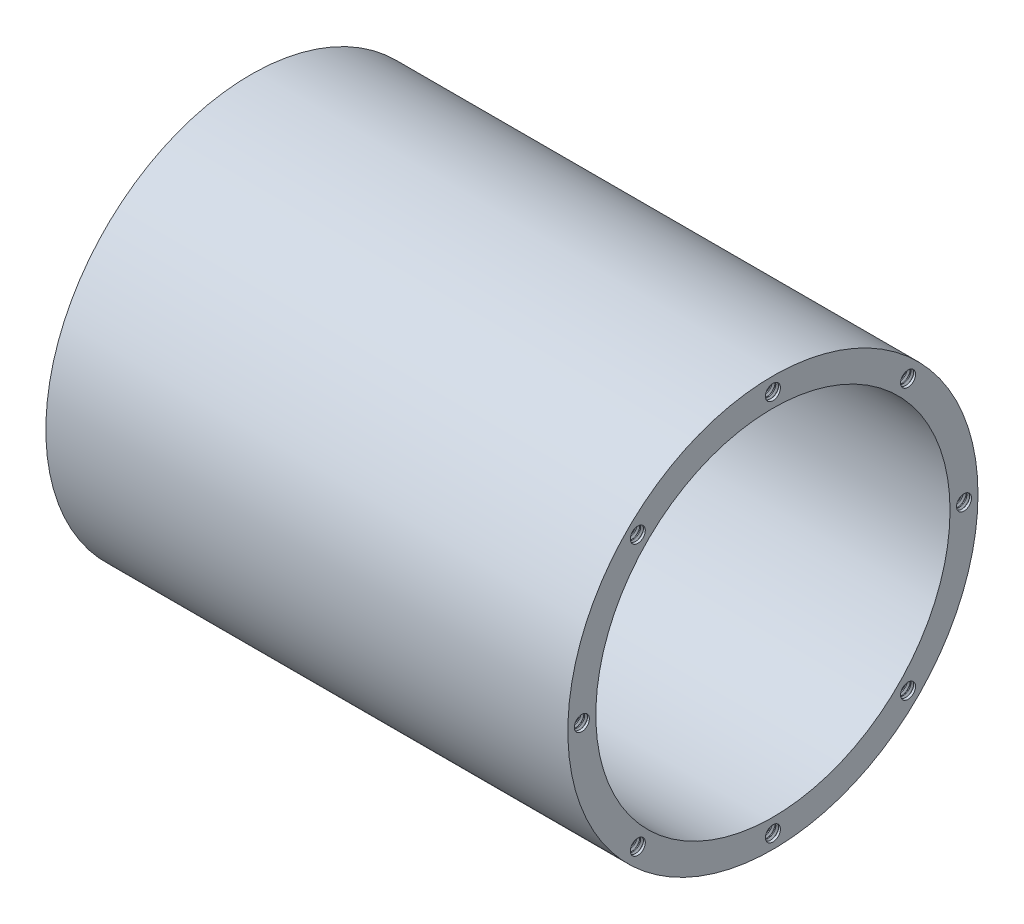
SolidWorks part; units mm, degrees
ref_plane "Front Plane" through (0, 0, 0) normal (0, 0, 1) x (1, 0, 0)
ref_plane "Top Plane" through (0, 0, 0) normal (0, 1, 0) x (1, 0, 0)
ref_plane "Right Plane" through (0, 0, 0) normal (1, 0, 0) x (0, 0, -1)
sketch "Sketch1" plane through (0, 0, 0) normal (1, 0, 0) x (0, 0, -1)
  circle A0 centre (0, 0) radius 69.85
  circle A1 centre (0, 0) radius 60.325
  dimension "D1" = 139.7
  dimension "D2" = 120.65
extrude "Boss-Extrude1" add sketch "Sketch1" along normal blind 177.8
sketch "Sketch2" plane through (0, 0, 0) normal (-1, 0, 0) x (0, 0, 1)
  line L0 (0, 0) -> (-65.0875, 0) construction
  circle A0 centre (0, 65.0875) radius 2.5527
  circle A1 centre (0, 0) radius 65.0875 construction
  circle A2 centre (46.0238, 46.0238) radius 2.5527
  circle A3 centre (65.0875, 0) radius 2.5527
  circle A4 centre (46.0238, -46.0238) radius 2.5527
  circle A5 centre (0, -65.0875) radius 2.5527
  circle A6 centre (-46.0238, -46.0238) radius 2.5527
  circle A7 centre (-65.0875, 0) radius 2.5527
  circle A8 centre (-46.0238, 46.0238) radius 2.5527
  point P4 (0, 0)
  point P5 (-65.0875, 0)
  point P21 (0, 0)
  dimension "D1" = 5.1054
  dimension "D2" = 65.0875
  dimension "D3" = 8
extrude "Cut-Extrude1" cut sketch "Sketch2" against normal blind 12.7
thread "Thread1" pitch 1.27 start angle 0, offset 0, length 12.7, pitch 1.27, diameter 5.1054
ref_plane "Plane2" through (0, 46.0238, -48.5765) normal (0, -1, 0) x (0, 0, -1)
sketch "Thread Profile2" plane through (0, 46.0238, -48.5765) normal (0, -1, 0) x (0, 0, -1)
  line L0 (0, 0) -> (0, 1.27) construction
  line L1 (0, 0) -> (0.6874, 0.3969)
  line L2 (0.6874, 0.3969) -> (0.6874, 0.5556)
  line L3 (0.6874, 0.5556) -> (0, 0.9525)
  line L4 (0.6874, 0.4762) -> (0, 0.4762) construction
  line L11 (0, 0) -> (0, 0.9525)
  point P2 (0, 0)
  dimension "Pitch" = 1.27
  dimension "Profile_Angle" = 60
  dimension "Profile_Land" = 0.1588
  dimension "Profile_Height" = 0.6874
thread "Thread2" pitch 1.27 start angle 0, offset 0, length 12.7, pitch 1.27, diameter 5.1054
ref_plane "Plane3" through (0, -65.0875, -2.5527) normal (0, -1, 0) x (0, 0, -1)
sketch "Thread Profile3" plane through (0, -65.0875, -2.5527) normal (0, -1, 0) x (0, 0, -1)
  line L0 (0, 0) -> (0, 1.27) construction
  line L1 (0, 0) -> (0.6874, 0.3969)
  line L2 (0.6874, 0.3969) -> (0.6874, 0.5556)
  line L3 (0.6874, 0.5556) -> (0, 0.9525)
  line L4 (0.6874, 0.4762) -> (0, 0.4762) construction
  line L11 (0, 0) -> (0, 0.9525)
  point P2 (0, 0)
  dimension "Pitch" = 1.27
  dimension "Profile_Angle" = 60
  dimension "Profile_Land" = 0.1588
  dimension "Profile_Height" = 0.6874
thread "Thread3" pitch 1.27 start angle 0, offset 0, length 12.7, pitch 1.27, diameter 5.1054
ref_plane "Plane5" through (0, -46.0238, -48.5765) normal (0, -1, 0) x (0, 0, -1)
sketch "Thread Profile5" plane through (0, -46.0238, -48.5765) normal (0, -1, 0) x (0, 0, -1)
  line L0 (0, 0) -> (0, 1.27) construction
  line L1 (0, 0) -> (0.6874, 0.3969)
  line L2 (0.6874, 0.3969) -> (0.6874, 0.5556)
  line L3 (0.6874, 0.5556) -> (0, 0.9525)
  line L4 (0.6874, 0.4762) -> (0, 0.4762) construction
  line L11 (0, 0) -> (0, 0.9525)
  point P2 (0, 0)
  dimension "Pitch" = 1.27
  dimension "Profile_Angle" = 60
  dimension "Profile_Land" = 0.1588
  dimension "Profile_Height" = 0.6874
thread "Thread4" pitch 1.27 start angle 0, offset 0, length 12.7, pitch 1.27, diameter 5.1054
ref_plane "Plane6" through (0, 0, -67.6402) normal (0, -1, 0) x (0, 0, -1)
sketch "Thread Profile6" plane through (0, 0, -67.6402) normal (0, -1, 0) x (0, 0, -1)
  line L0 (0, 0) -> (0, 1.27) construction
  line L1 (0, 0) -> (0.6874, 0.3969)
  line L2 (0.6874, 0.3969) -> (0.6874, 0.5556)
  line L3 (0.6874, 0.5556) -> (0, 0.9525)
  line L4 (0.6874, 0.4762) -> (0, 0.4762) construction
  line L11 (0, 0) -> (0, 0.9525)
  point P2 (0, 0)
  dimension "Pitch" = 1.27
  dimension "Profile_Angle" = 60
  dimension "Profile_Land" = 0.1588
  dimension "Profile_Height" = 0.6874
thread "Thread5" pitch 1.27 start angle 0, offset 0, length 12.7, pitch 1.27, diameter 5.1054
ref_plane "Plane7" through (0, 65.0875, -2.5527) normal (0, -1, 0) x (0, 0, -1)
sketch "Thread Profile7" plane through (0, 65.0875, -2.5527) normal (0, -1, 0) x (0, 0, -1)
  line L0 (0, 0) -> (0, 1.27) construction
  line L1 (0, 0) -> (0.6874, 0.3969)
  line L2 (0.6874, 0.3969) -> (0.6874, 0.5556)
  line L3 (0.6874, 0.5556) -> (0, 0.9525)
  line L4 (0.6874, 0.4762) -> (0, 0.4762) construction
  line L11 (0, 0) -> (0, 0.9525)
  point P2 (0, 0)
  dimension "Pitch" = 1.27
  dimension "Profile_Angle" = 60
  dimension "Profile_Land" = 0.1588
  dimension "Profile_Height" = 0.6874
thread "Thread6" pitch 1.27 start angle 0, offset 0, length 12.7, pitch 1.27, diameter 5.1054
ref_plane "Plane8" through (0, -46.0238, 43.4711) normal (0, -1, 0) x (0, 0, -1)
sketch "Thread Profile8" plane through (0, -46.0238, 43.4711) normal (0, -1, 0) x (0, 0, -1)
  line L0 (0, 0) -> (0, 1.27) construction
  line L1 (0, 0) -> (0.6874, 0.3969)
  line L2 (0.6874, 0.3969) -> (0.6874, 0.5556)
  line L3 (0.6874, 0.5556) -> (0, 0.9525)
  line L4 (0.6874, 0.4762) -> (0, 0.4762) construction
  line L11 (0, 0) -> (0, 0.9525)
  point P2 (0, 0)
  dimension "Pitch" = 1.27
  dimension "Profile_Angle" = 60
  dimension "Profile_Land" = 0.1588
  dimension "Profile_Height" = 0.6874
thread "Thread7" pitch 1.27 start angle 0, offset 0, length 12.7, pitch 1.27, diameter 5.1054
ref_plane "Plane9" through (0, 46.0238, 43.4711) normal (0, -1, 0) x (0, 0, -1)
sketch "Thread Profile9" plane through (0, 46.0238, 43.4711) normal (0, -1, 0) x (0, 0, -1)
  line L0 (0, 0) -> (0, 1.27) construction
  line L1 (0, 0) -> (0.6874, 0.3969)
  line L2 (0.6874, 0.3969) -> (0.6874, 0.5556)
  line L3 (0.6874, 0.5556) -> (0, 0.9525)
  line L4 (0.6874, 0.4762) -> (0, 0.4762) construction
  line L11 (0, 0) -> (0, 0.9525)
  point P2 (0, 0)
  dimension "Pitch" = 1.27
  dimension "Profile_Angle" = 60
  dimension "Profile_Land" = 0.1588
  dimension "Profile_Height" = 0.6874
thread "Thread8" pitch 1.27 start angle 0, offset 0, length 12.7, pitch 1.27, diameter 5.1054
ref_plane "Plane10" through (0, 0, 62.5348) normal (0, -1, 0) x (0, 0, -1)
sketch "Thread Profile10" plane through (0, 0, 62.5348) normal (0, -1, 0) x (0, 0, -1)
  line L0 (0, 0) -> (0, 1.27) construction
  line L1 (0, 0) -> (0.6874, 0.3969)
  line L2 (0.6874, 0.3969) -> (0.6874, 0.5556)
  line L3 (0.6874, 0.5556) -> (0, 0.9525)
  line L4 (0.6874, 0.4762) -> (0, 0.4762) construction
  line L11 (0, 0) -> (0, 0.9525)
  point P2 (0, 0)
  dimension "Pitch" = 1.27
  dimension "Profile_Angle" = 60
  dimension "Profile_Land" = 0.1588
  dimension "Profile_Height" = 0.6874
sketch "Sketch27" plane through (177.8, 0, 0) normal (1, 0, 0) x (0, 0, -1)
  circle A0 centre (0, 65.0875) radius 2.5527
  circle A1 centre (46.0238, 46.0238) radius 2.5527
  circle A2 centre (65.0875, 0) radius 2.5527
  circle A3 centre (46.0238, -46.0238) radius 2.5527
  circle A4 centre (0, -65.0875) radius 2.5527
  circle A5 centre (-46.0238, -46.0238) radius 2.5527
  circle A6 centre (-65.0875, 0) radius 2.5527
  circle A7 centre (-46.0238, 46.0238) radius 2.5527
  point P4 (0, 0)
  point P5 (0, 0)
  point P19 (0, 0)
  dimension "D1" = 5.1054
  dimension "D2" = 8
extrude "Cut-Extrude2" cut sketch "Sketch27" against normal blind 12.7
thread "Thread9" pitch 1.27 start angle 0, offset 0, length 12.7, pitch 1.27, diameter 5.1054
ref_plane "Plane11" through (177.8, 46.0238, 48.5765) normal (0, -1, 0) x (0, 0, 1)
sketch "Thread Profile11" plane through (177.8, 46.0238, 48.5765) normal (0, -1, 0) x (0, 0, 1)
  line L0 (0, 0) -> (0, 1.27) construction
  line L1 (0, 0) -> (0.6874, 0.3969)
  line L2 (0.6874, 0.3969) -> (0.6874, 0.5556)
  line L3 (0.6874, 0.5556) -> (0, 0.9525)
  line L4 (0.6874, 0.4762) -> (0, 0.4762) construction
  line L11 (0, 0) -> (0, 0.9525)
  point P2 (0, 0)
  dimension "Pitch" = 1.27
  dimension "Profile_Angle" = 60
  dimension "Profile_Land" = 0.1588
  dimension "Profile_Height" = 0.6874
thread "Thread10" pitch 1.27 start angle 0, offset 0, length 12.7, pitch 1.27, diameter 5.1054
ref_plane "Plane12" through (177.8, 0, 67.6402) normal (0, -1, 0) x (0, 0, 1)
sketch "Thread Profile12" plane through (177.8, 0, 67.6402) normal (0, -1, 0) x (0, 0, 1)
  line L0 (0, 0) -> (0, 1.27) construction
  line L1 (0, 0) -> (0.6874, 0.3969)
  line L2 (0.6874, 0.3969) -> (0.6874, 0.5556)
  line L3 (0.6874, 0.5556) -> (0, 0.9525)
  line L4 (0.6874, 0.4762) -> (0, 0.4762) construction
  line L11 (0, 0) -> (0, 0.9525)
  point P2 (0, 0)
  dimension "Pitch" = 1.27
  dimension "Profile_Angle" = 60
  dimension "Profile_Land" = 0.1588
  dimension "Profile_Height" = 0.6874
thread "Thread11" pitch 1.27 start angle 0, offset 0, length 12.7, pitch 1.27, diameter 5.1054
ref_plane "Plane13" through (177.8, -46.0238, 48.5765) normal (0, -1, 0) x (0, 0, 1)
sketch "Thread Profile13" plane through (177.8, -46.0238, 48.5765) normal (0, -1, 0) x (0, 0, 1)
  line L0 (0, 0) -> (0, 1.27) construction
  line L1 (0, 0) -> (0.6874, 0.3969)
  line L2 (0.6874, 0.3969) -> (0.6874, 0.5556)
  line L3 (0.6874, 0.5556) -> (0, 0.9525)
  line L4 (0.6874, 0.4762) -> (0, 0.4762) construction
  line L11 (0, 0) -> (0, 0.9525)
  point P2 (0, 0)
  dimension "Pitch" = 1.27
  dimension "Profile_Angle" = 60
  dimension "Profile_Land" = 0.1588
  dimension "Profile_Height" = 0.6874
thread "Thread12" pitch 1.27 start angle 0, offset 0, length 12.7, pitch 1.27, diameter 5.1054
ref_plane "Plane14" through (177.8, -65.0875, 2.5527) normal (0, -1, 0) x (0, 0, 1)
sketch "Thread Profile14" plane through (177.8, -65.0875, 2.5527) normal (0, -1, 0) x (0, 0, 1)
  line L0 (0, 0) -> (0, 1.27) construction
  line L1 (0, 0) -> (0.6874, 0.3969)
  line L2 (0.6874, 0.3969) -> (0.6874, 0.5556)
  line L3 (0.6874, 0.5556) -> (0, 0.9525)
  line L4 (0.6874, 0.4762) -> (0, 0.4762) construction
  line L11 (0, 0) -> (0, 0.9525)
  point P2 (0, 0)
  dimension "Pitch" = 1.27
  dimension "Profile_Angle" = 60
  dimension "Profile_Land" = 0.1588
  dimension "Profile_Height" = 0.6874
thread "Thread13" pitch 1.27 start angle 0, offset 0, length 12.7, pitch 1.27, diameter 5.1054
ref_plane "Plane15" through (177.8, -46.0238, -43.4711) normal (0, -1, 0) x (0, 0, 1)
sketch "Thread Profile15" plane through (177.8, -46.0238, -43.4711) normal (0, -1, 0) x (0, 0, 1)
  line L0 (0, 0) -> (0, 1.27) construction
  line L1 (0, 0) -> (0.6874, 0.3969)
  line L2 (0.6874, 0.3969) -> (0.6874, 0.5556)
  line L3 (0.6874, 0.5556) -> (0, 0.9525)
  line L4 (0.6874, 0.4762) -> (0, 0.4762) construction
  line L11 (0, 0) -> (0, 0.9525)
  point P2 (0, 0)
  dimension "Pitch" = 1.27
  dimension "Profile_Angle" = 60
  dimension "Profile_Land" = 0.1588
  dimension "Profile_Height" = 0.6874
thread "Thread14" pitch 1.27 start angle 0, offset 0, length 12.7, pitch 1.27, diameter 5.1054
ref_plane "Plane16" through (177.8, 0, -62.5348) normal (0, -1, 0) x (0, 0, 1)
sketch "Thread Profile16" plane through (177.8, 0, -62.5348) normal (0, -1, 0) x (0, 0, 1)
  line L0 (0, 0) -> (0, 1.27) construction
  line L1 (0, 0) -> (0.6874, 0.3969)
  line L2 (0.6874, 0.3969) -> (0.6874, 0.5556)
  line L3 (0.6874, 0.5556) -> (0, 0.9525)
  line L4 (0.6874, 0.4762) -> (0, 0.4762) construction
  line L11 (0, 0) -> (0, 0.9525)
  point P2 (0, 0)
  dimension "Pitch" = 1.27
  dimension "Profile_Angle" = 60
  dimension "Profile_Land" = 0.1588
  dimension "Profile_Height" = 0.6874
thread "Thread15" pitch 1.27 start angle 0, offset 0, length 12.7, pitch 1.27, diameter 5.1054
ref_plane "Plane17" through (177.8, 46.0238, -43.4711) normal (0, -1, 0) x (0, 0, 1)
sketch "Thread Profile17" plane through (177.8, 46.0238, -43.4711) normal (0, -1, 0) x (0, 0, 1)
  line L0 (0, 0) -> (0, 1.27) construction
  line L1 (0, 0) -> (0.6874, 0.3969)
  line L2 (0.6874, 0.3969) -> (0.6874, 0.5556)
  line L3 (0.6874, 0.5556) -> (0, 0.9525)
  line L4 (0.6874, 0.4762) -> (0, 0.4762) construction
  line L11 (0, 0) -> (0, 0.9525)
  point P2 (0, 0)
  dimension "Pitch" = 1.27
  dimension "Profile_Angle" = 60
  dimension "Profile_Land" = 0.1588
  dimension "Profile_Height" = 0.6874
thread "Thread16" pitch 1.27 start angle 0, offset 0, length 12.7, pitch 1.27, diameter 5.1054
ref_plane "Plane18" through (177.8, 65.0875, 2.5527) normal (0, -1, 0) x (0, 0, 1)
sketch "Thread Profile18" plane through (177.8, 65.0875, 2.5527) normal (0, -1, 0) x (0, 0, 1)
  line L0 (0, 0) -> (0, 1.27) construction
  line L1 (0, 0) -> (0.6874, 0.3969)
  line L2 (0.6874, 0.3969) -> (0.6874, 0.5556)
  line L3 (0.6874, 0.5556) -> (0, 0.9525)
  line L4 (0.6874, 0.4762) -> (0, 0.4762) construction
  line L11 (0, 0) -> (0, 0.9525)
  point P2 (0, 0)
  dimension "Pitch" = 1.27
  dimension "Profile_Angle" = 60
  dimension "Profile_Land" = 0.1588
  dimension "Profile_Height" = 0.6874
